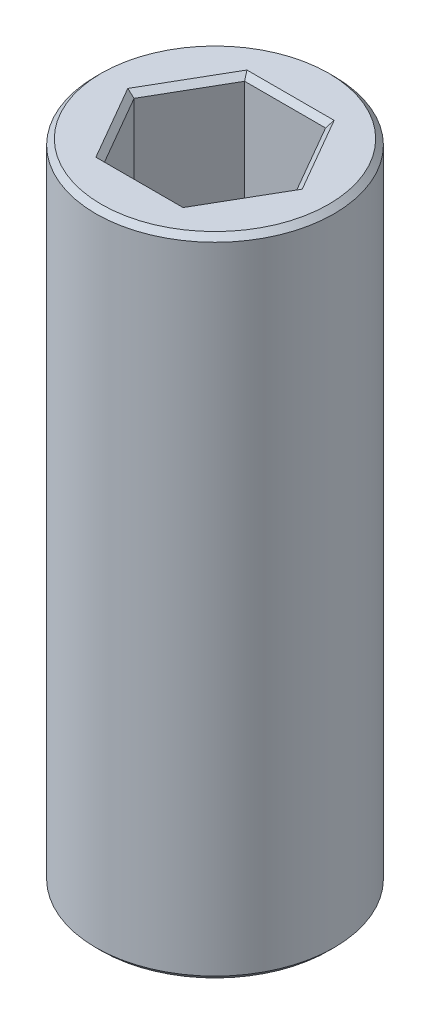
SolidWorks part; units mm, degrees
ref_plane "Front Plane" through (0, 0, 0) normal (0, 0, 1) x (1, 0, 0)
ref_plane "Top Plane" through (0, 0, 0) normal (0, 1, 0) x (1, 0, 0)
ref_plane "Right Plane" through (0, 0, 0) normal (1, 0, 0) x (0, 0, -1)
sketch "Sketch1" plane through (0, 0, 0) normal (0, 1, 0) x (1, 0, 0)
  line L1 (7.5523, 0) -> (3.7762, 6.5405)
  line L2 (3.7762, 6.5405) -> (-3.7762, 6.5405)
  line L3 (-3.7762, 6.5405) -> (-7.5523, 0)
  line L4 (-7.5523, 0) -> (-3.7762, -6.5405)
  line L5 (-3.7762, -6.5405) -> (3.7762, -6.5405)
  line L6 (3.7762, -6.5405) -> (7.5523, 0)
  circle A0 centre (0, 0) radius 11.1125
  circle A1 centre (0, 0) radius 6.5405 construction
  dimension "D1" = 13.081
  dimension "D2" = 22.225
extrude "Boss-Extrude1" add sketch "Sketch1" along normal blind 60.325
chamfer "Chamfer1" distance 0.508 angle 45 14 edges at (-5.6642, 0, -3.2702) (-5.6642, 0, 3.2703) (0, 0, 6.5405) (5.6642, 0, 3.2702) (5.6642, 0, -3.2703) (0, 0, -6.5405) (0, 0, 11.1125) (0, 60.325, 11.1125) (-5.6642, 60.325, 3.2703) (0, 60.325, 6.5405) (5.6642, 60.325, 3.2702) (5.6642, 60.325, -3.2703) (0, 60.325, -6.5405) (-5.6642, 60.325, -3.2702)
